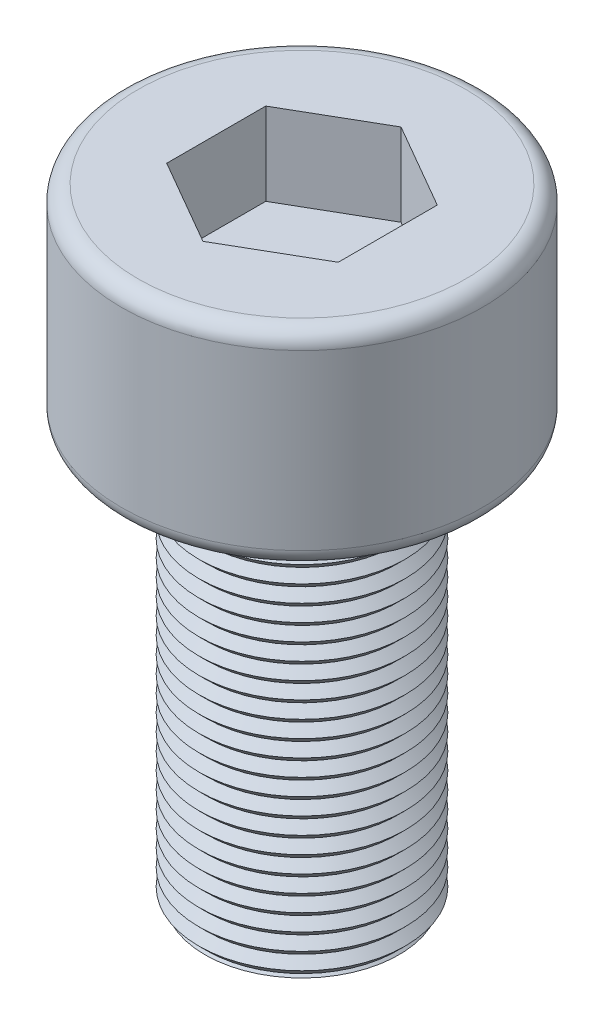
SolidWorks part; units mm, degrees
ref_plane "Front Plane" through (0, 0, 0) normal (0, 0, 1) x (1, 0, 0)
ref_plane "Top Plane" through (0, 0, 0) normal (0, 1, 0) x (1, 0, 0)
ref_plane "Right Plane" through (0, 0, 0) normal (1, 0, 0) x (0, 0, -1)
sketch "Sketch1" plane through (0, 0, 0) normal (0, 0, 1) x (1, 0, 0)
  line L0 (-1.4586, 6.35) -> (-1.5875, 6.35)
  line L1 (-2.7781, 6.35) -> (-2.7781, 9.525)
  line L2 (-2.7781, 9.525) -> (0, 9.525)
  line L3 (-1.4586, 6.35) -> (-1.5875, 6.35)
  line L4 (-1.493, 0) -> (-1.4586, 0.0344)
  line L5 (-1.4586, 0.0344) -> (-1.5875, 0.1633)
  line L6 (-1.5875, 0.1633) -> (-1.4586, 0.2922)
  line L7 (-1.4586, 0.2922) -> (-1.5875, 0.4211)
  line L8 (-1.5875, 0.4211) -> (-1.4586, 0.55)
  line L9 (-1.4586, 0.55) -> (-1.5875, 0.6789)
  line L10 (-1.5875, 0.6789) -> (-1.4586, 0.8078)
  line L11 (-1.4586, 0.8078) -> (-1.5875, 0.9367)
  line L12 (-1.5875, 0.9367) -> (-1.4586, 1.0655)
  line L13 (-1.4586, 1.0655) -> (-1.5875, 1.1944)
  line L14 (-1.5875, 1.1944) -> (-1.4586, 1.3233)
  line L15 (-1.4586, 1.3233) -> (-1.5875, 1.4522)
  line L16 (-1.5875, 1.4522) -> (-1.4586, 1.5811)
  line L17 (-1.4586, 1.5811) -> (-1.5875, 1.71)
  line L18 (-1.5875, 1.71) -> (-1.4586, 1.8389)
  line L19 (-1.4586, 1.8389) -> (-1.5875, 1.9678)
  line L20 (-1.5875, 1.9678) -> (-1.4586, 2.0967)
  line L21 (-1.4586, 2.0967) -> (-1.5875, 2.2255)
  line L22 (-1.5875, 2.2255) -> (-1.4586, 2.3544)
  line L23 (-1.4586, 2.3544) -> (-1.5875, 2.4833)
  line L24 (-1.5875, 2.4833) -> (-1.4586, 2.6122)
  line L25 (-1.4586, 2.6122) -> (-1.5875, 2.7411)
  line L26 (-1.5875, 2.7411) -> (-1.4586, 2.87)
  line L27 (-1.4586, 2.87) -> (-1.5875, 2.9989)
  line L28 (-1.5875, 2.9989) -> (-1.4586, 3.1278)
  line L29 (-1.4586, 3.1278) -> (-1.5875, 3.2567)
  line L30 (-1.5875, 3.2567) -> (-1.4586, 3.3855)
  line L31 (-1.4586, 3.3855) -> (-1.5875, 3.5144)
  line L32 (-1.5875, 3.5144) -> (-1.4586, 3.6433)
  line L33 (-1.4586, 3.6433) -> (-1.5875, 3.7722)
  line L34 (-1.5875, 3.7722) -> (-1.4586, 3.9011)
  line L35 (-1.4586, 3.9011) -> (-1.5875, 4.03)
  line L36 (-1.5875, 4.03) -> (-1.4586, 4.1589)
  line L37 (-1.4586, 4.1589) -> (-1.5875, 4.2878)
  line L38 (-1.5875, 4.2878) -> (-1.4586, 4.4167)
  line L39 (-1.4586, 4.4167) -> (-1.5875, 4.5455)
  line L40 (-1.5875, 4.5455) -> (-1.4586, 4.6744)
  line L41 (-1.4586, 4.6744) -> (-1.5875, 4.8033)
  line L42 (-1.5875, 4.8033) -> (-1.4586, 4.9322)
  line L43 (-1.4586, 4.9322) -> (-1.5875, 5.0611)
  line L44 (-1.5875, 5.0611) -> (-1.4586, 5.19)
  line L45 (-1.4586, 5.19) -> (-1.5875, 5.3189)
  line L46 (-1.5875, 5.3189) -> (-1.4586, 5.4478)
  line L47 (-1.4586, 5.4478) -> (-1.5875, 5.5767)
  line L48 (-1.5875, 5.5767) -> (-1.4586, 5.7055)
  line L49 (-1.5875, 6.0922) -> (-1.4586, 6.2211)
  line L50 (-1.4586, 6.2211) -> (-1.4586, 6.35)
  line L51 (-2.7781, 9.525) -> (0, 9.525)
  line L52 (-1.4586, 5.7055) -> (-1.5875, 5.8344)
  line L53 (-1.5875, 5.8344) -> (-1.4586, 5.9633)
  line L54 (-1.4586, 5.9633) -> (-1.5875, 6.0922)
  line L55 (-1.5875, 6.0922) -> (-1.4586, 6.2211)
  line L56 (-1.493, 0) -> (0, 0)
  line L57 (0, 9.525) -> (0, 0)
  line L58 (-1.4586, 6.35) -> (-1.5875, 6.35)
  line L59 (-2.7781, 6.35) -> (-2.7781, 9.525)
  line L60 (-2.7781, 9.525) -> (0, 9.525)
  line L61 (-1.4586, 6.35) -> (-1.5875, 6.35)
  line L62 (-1.493, 0) -> (-1.4586, 0.0344)
  line L63 (-1.4586, 0.0344) -> (-1.5875, 0.1633)
  line L64 (-1.5875, 0.1633) -> (-1.4586, 0.2922)
  line L65 (-1.4586, 0.2922) -> (-1.5875, 0.4211)
  line L66 (-1.5875, 0.4211) -> (-1.4586, 0.55)
  line L67 (-1.4586, 0.55) -> (-1.5875, 0.6789)
  line L68 (-1.5875, 0.6789) -> (-1.4586, 0.8078)
  line L69 (-1.4586, 0.8078) -> (-1.5875, 0.9367)
  line L70 (-1.5875, 0.9367) -> (-1.4586, 1.0655)
  line L71 (-1.4586, 1.0655) -> (-1.5875, 1.1944)
  line L72 (-1.5875, 1.1944) -> (-1.4586, 1.3233)
  line L73 (-1.4586, 1.3233) -> (-1.5875, 1.4522)
  line L74 (-1.5875, 1.4522) -> (-1.4586, 1.5811)
  line L75 (-1.4586, 1.5811) -> (-1.5875, 1.71)
  line L76 (-1.5875, 1.71) -> (-1.4586, 1.8389)
  line L77 (-1.4586, 1.8389) -> (-1.5875, 1.9678)
  line L78 (-1.5875, 1.9678) -> (-1.4586, 2.0967)
  line L79 (-1.4586, 2.0967) -> (-1.5875, 2.2255)
  line L80 (-1.5875, 2.2255) -> (-1.4586, 2.3544)
  line L81 (-1.4586, 2.3544) -> (-1.5875, 2.4833)
  line L82 (-1.5875, 2.4833) -> (-1.4586, 2.6122)
  line L83 (-1.4586, 2.6122) -> (-1.5875, 2.7411)
  line L84 (-1.5875, 2.7411) -> (-1.4586, 2.87)
  line L85 (-1.4586, 2.87) -> (-1.5875, 2.9989)
  line L86 (-1.5875, 2.9989) -> (-1.4586, 3.1278)
  line L87 (-1.4586, 3.1278) -> (-1.5875, 3.2567)
  line L88 (-1.5875, 3.2567) -> (-1.4586, 3.3855)
  line L89 (-1.4586, 3.3855) -> (-1.5875, 3.5144)
  line L90 (-1.5875, 3.5144) -> (-1.4586, 3.6433)
  line L91 (-1.4586, 3.6433) -> (-1.5875, 3.7722)
  line L92 (-1.5875, 3.7722) -> (-1.4586, 3.9011)
  line L93 (-1.4586, 3.9011) -> (-1.5875, 4.03)
  line L94 (-1.5875, 4.03) -> (-1.4586, 4.1589)
  line L95 (-1.4586, 4.1589) -> (-1.5875, 4.2878)
  line L96 (-1.5875, 4.2878) -> (-1.4586, 4.4167)
  line L97 (-1.4586, 4.4167) -> (-1.5875, 4.5455)
  line L98 (-1.5875, 4.5455) -> (-1.4586, 4.6744)
  line L99 (-1.4586, 4.6744) -> (-1.5875, 4.8033)
  line L100 (-1.5875, 4.8033) -> (-1.4586, 4.9322)
  line L101 (-1.4586, 4.9322) -> (-1.5875, 5.0611)
  line L102 (-1.5875, 5.0611) -> (-1.4586, 5.19)
  line L103 (-1.4586, 5.19) -> (-1.5875, 5.3189)
  line L104 (-1.5875, 5.3189) -> (-1.4586, 5.4478)
  line L105 (-1.4586, 5.4478) -> (-1.5875, 5.5767)
  line L106 (-1.5875, 5.5767) -> (-1.4586, 5.7055)
  line L107 (-1.5875, 6.0922) -> (-1.4586, 6.2211)
  line L108 (-1.4586, 6.2211) -> (-1.4586, 6.35)
  line L109 (-2.7781, 9.525) -> (0, 9.525)
  line L110 (-1.4586, 5.7055) -> (-1.5875, 5.8344)
  line L111 (-1.5875, 5.8344) -> (-1.4586, 5.9633)
  line L112 (-1.4586, 5.9633) -> (-1.5875, 6.0922)
  line L113 (-1.5875, 6.0922) -> (-1.4586, 6.2211)
  line L114 (-1.493, 0) -> (0, 0)
  line L115 (0, 9.525) -> (0, 0)
  line L116 (-1.5875, 6.35) -> (-2.7781, 6.35)
  dimension "D1" = 9.525
revolve "Revolve1" add sketch "Sketch1" angle 360 about L57
sketch "Sketch2" plane through (0, 9.525, 0) normal (0, 1, 0) x (1, 0, 0)
  line L1 (0, 1.524) -> (-1.3198, 0.762)
  line L2 (-1.3198, 0.762) -> (-1.3198, -0.762)
  line L3 (-1.3198, -0.762) -> (0, -1.524)
  line L4 (0, -1.524) -> (1.3198, -0.762)
  line L5 (1.3198, -0.762) -> (1.3198, 0.762)
  line L6 (1.3198, 0.762) -> (0, 1.524)
  circle A0 centre (0, 0) radius 1.3198 construction
  dimension "D1" = 3.048
extrude "Cut-Extrude1" cut sketch "Sketch2" against normal blind 1.27
fillet "Fillet1" radius 0.254 2 edges at (0, 6.35, 2.7781) (0, 9.525, 2.7781)
